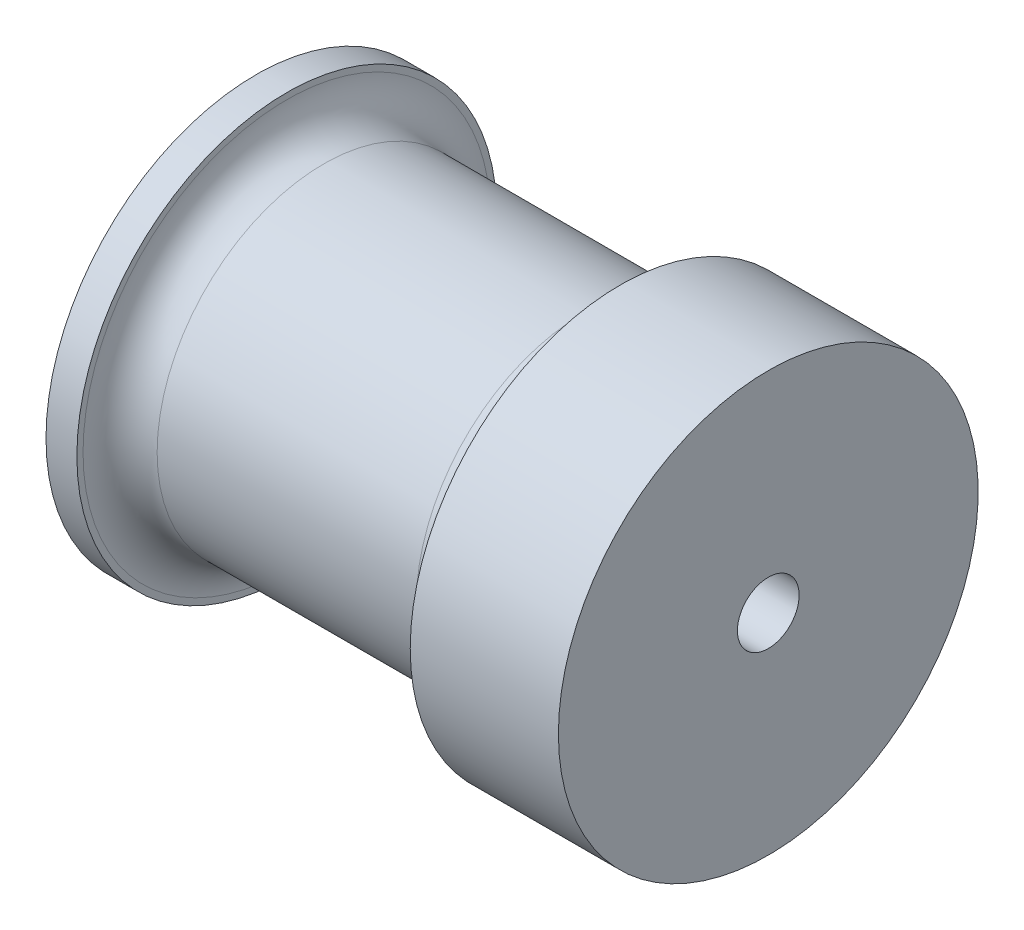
SolidWorks part; units mm, degrees
ref_plane "Front Plane" through (0, 0, 0) normal (0, 0, 1) x (1, 0, 0)
ref_plane "Top Plane" through (0, 0, 0) normal (0, 1, 0) x (1, 0, 0)
ref_plane "Right Plane" through (0, 0, 0) normal (1, 0, 0) x (0, 0, -1)
sketch "Sketch1" plane through (0, 0, 0) normal (0, 0, 1) x (1, 0, 0)
  line L1 (-29.5275, 3.175) -> (-29.5275, 9.525)
  line L2 (-29.5275, 9.525) -> (-23.1775, 9.525)
  line L3 (-23.1775, 9.525) -> (-23.1775, 21.59)
  line L4 (-23.1775, 21.59) -> (-20.0025, 21.59)
  line L5 (-20.0025, 21.59) -> (-20.0025, 17.145)
  line L6 (-20.0025, 17.145) -> (14.2875, 17.145)
  line L7 (14.2875, 17.145) -> (14.2875, 21.59)
  line L8 (14.2875, 21.59) -> (29.5275, 21.59)
  line L9 (29.5275, 21.59) -> (29.5275, 3.175)
  line L13 (-29.5275, 3.175) -> (29.5275, 3.175)
  line L14 (-18.0736, 0) -> (18.7564, 0) construction
  point P3 (0, 3.175)
  dimension "D1" = 3.175
  dimension "D2" = 6.35
  dimension "D3" = 3.175
  dimension "D4" = 34.29
  dimension "D5" = 6.35
  dimension "D6" = 21.59
  dimension "D7" = 13.97
  dimension "D8" = 15.24
revolve "Revolve1" add sketch "Sketch1" angle 360 about L14
sketch "Sketch2" plane through (0, 0, 0) normal (0, 1, 0) x (1, 0, 0)
  line L0 (-29.5275, 0) -> (-23.1775, 0) construction
  line L1 (-29.5275, 9.525) -> (-29.5275, -9.525) construction
  line L2 (-23.1775, 21.59) -> (-23.1775, -21.59) construction
  circle A0 centre (-26.3525, 0) radius 0.9922
  dimension "D1" = 1.9844
extrude "Cut-Extrude1" cut sketch "Sketch2" against normal through all both and the other way through all
fillet "Fillet13" radius 3.81 2 edges at (14.2875, 0, 17.145) (-20.0025, 0, 17.145)
